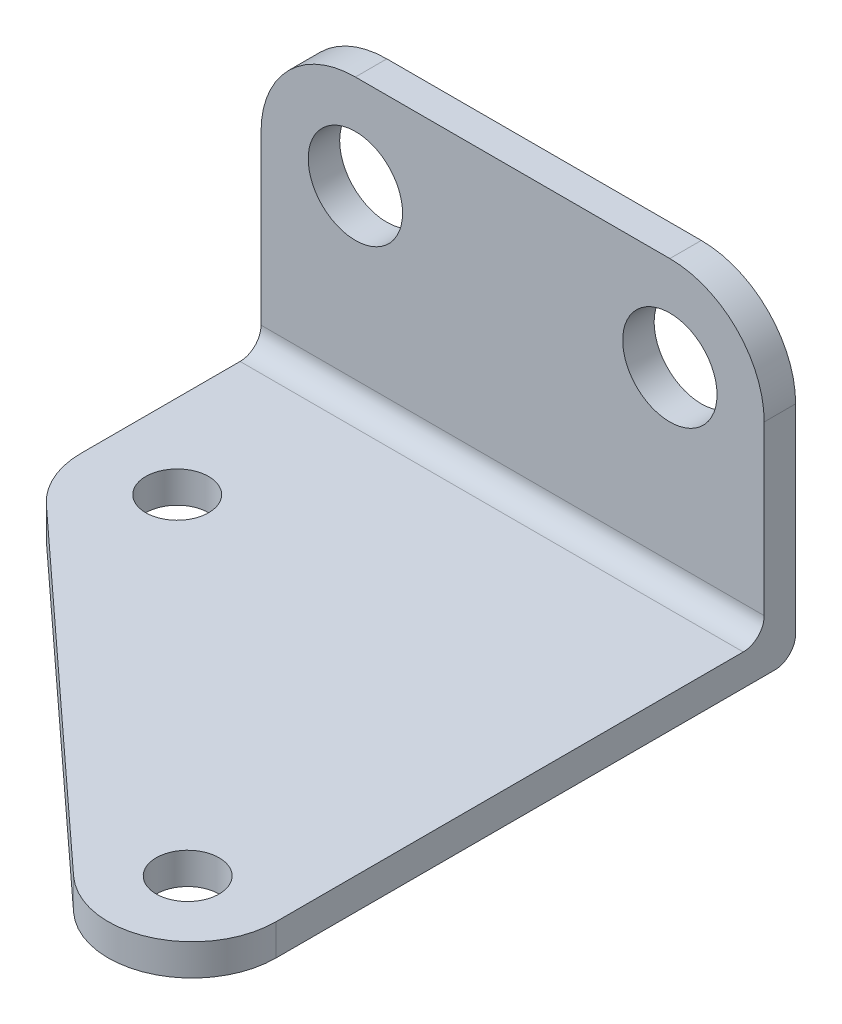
SolidWorks part; units mm, degrees
ref_plane "Front Plane" through (0, 0, 0) normal (0, 0, 1) x (1, 0, 0)
ref_plane "Top Plane" through (0, 0, 0) normal (0, 1, 0) x (1, 0, 0)
ref_plane "Right Plane" through (0, 0, 0) normal (1, 0, 0) x (0, 0, -1)
sketch "Sketch1" plane through (0, 0, 0) normal (0, 0, 1) x (1, 0, 0)
  line L1 (0, 0) -> (-48, 0)
  line L2 (0, 0) -> (0, -27)
  line L3 (0, -27) -> (-48, -27)
  line L4 (-48, 0) -> (-48, -27)
  circle A0 centre (-39, -18) radius 4.5
  circle A1 centre (-9, -18) radius 4.5
  dimension "D1" = 9
  dimension "D3" = 30
  dimension "D2" = 27
  dimension "D4" = 18
  dimension "D5" = 9
  dimension "D6" = 48
extrude "Boss-Extrude1" add sketch "Sketch1" along normal blind 3
fillet "Fillet1" radius 9 2 edges at (0, -27, 1.5) (-48, -27, 1.5)
ref_plane "Plane1" through (0, 0, 0) normal (0, 1, 0) x (1, 0, 0)
sketch "Sketch2" plane through (0, 0, 0) normal (0, 1, 0) x (1, 0, 0)
  line L0 (0, 0) -> (0, -67.7905)
  line L1 (0, 0) -> (-48, 0)
  line L2 (-48, -23.6919) -> (0, -67.7905)
  line L4 (-48, 0) -> (-48, -23.6919)
  line L5 (0, -3) -> (-48, -3) construction
  circle A0 centre (-40, -19) radius 3
  circle A1 centre (-8, -50) radius 3
  dimension "D1" = 6
  dimension "D3" = 32
  dimension "D4" = 31
  dimension "D5" = 8
  dimension "D6" = 16
extrude "Boss-Extrude2" add sketch "Sketch2" along normal blind 3
fillet "Fillet2" radius 8 1 edges at (0, 1.5, 67.7905)
fillet "Fillet3" radius 8 1 edges at (-48, 1.5, 23.6919)
fillet "Fillet4" radius 2 2 edges at (-24, 3, 0) (-24, 0, 3)
mirror "Mirror4" about plane through (0, 3, 0) normal (0, 1, 0) of "Fillet2", "Boss-Extrude2", "Boss-Extrude1"
sketch "Sketch4" plane through (0, 6, 0) normal (0, 1, 0) x (1, 0, 0)
  line L1 (0, 0) -> (-48, 0)
  line L2 (0, 0) -> (0, -3)
  line L3 (0, -3) -> (-48, -3)
  line L4 (-48, 0) -> (-48, -3)
  dimension "D1" = 3
  dimension "D2" = 48
extrude "Boss-Extrude3" add sketch "Sketch4" along normal blind 27
fillet "Fillet5" radius 9 2 edges at (0, 33, 1.5) (-48, 33, 1.5)
sketch "Sketch5" plane through (0, 0, 0) normal (1, 0, 0) x (0, 0, -1)
  line L1 (0, 3) -> (-58.9168, 3)
  line L2 (0, 3) -> (0, -28.9314)
  line L3 (0, -28.9314) -> (-58.9168, -28.9314)
  line L4 (-58.9168, 3) -> (-58.9168, -28.9314)
extrude "Cut-Extrude1" cut sketch "Sketch5" against normal blind 67
fillet "Fillet6" radius 8 1 edges at (-48, 4.5, 23.6919)
fillet "Fillet7" radius 2 1 edges at (-24, 3, 0)
fillet "Fillet8" radius 2 1 edges at (-24, 6, 3)
sketch "Sketch6" plane through (0, 0, 3) normal (0, 0, 1) x (1, 0, 0)
  circle A0 centre (-39, 24) radius 4.5
  point P2 (0, 0)
  point P3 (-33.9397, 21.5898)
  point P4 (0, 0)
  point P5 (0, 0)
  point P6 (0, 0)
  point P7 (-36.5256, 23.3731)
  point P8 (0, 0)
  point P9 (-37.5064, 21.679)
  point P10 (-34.6531, 21.8573)
  point P11 (-39, 24)
extrude "Cut-Extrude2" cut sketch "Sketch6" against normal blind 67
sketch "Sketch7" plane through (0, 0, 3) normal (0, 0, 1) x (1, 0, 0)
  circle A0 centre (-9, 24) radius 4.5
  point P2 (-9, 24)
extrude "Cut-Extrude3" cut sketch "Sketch7" against normal blind 67
